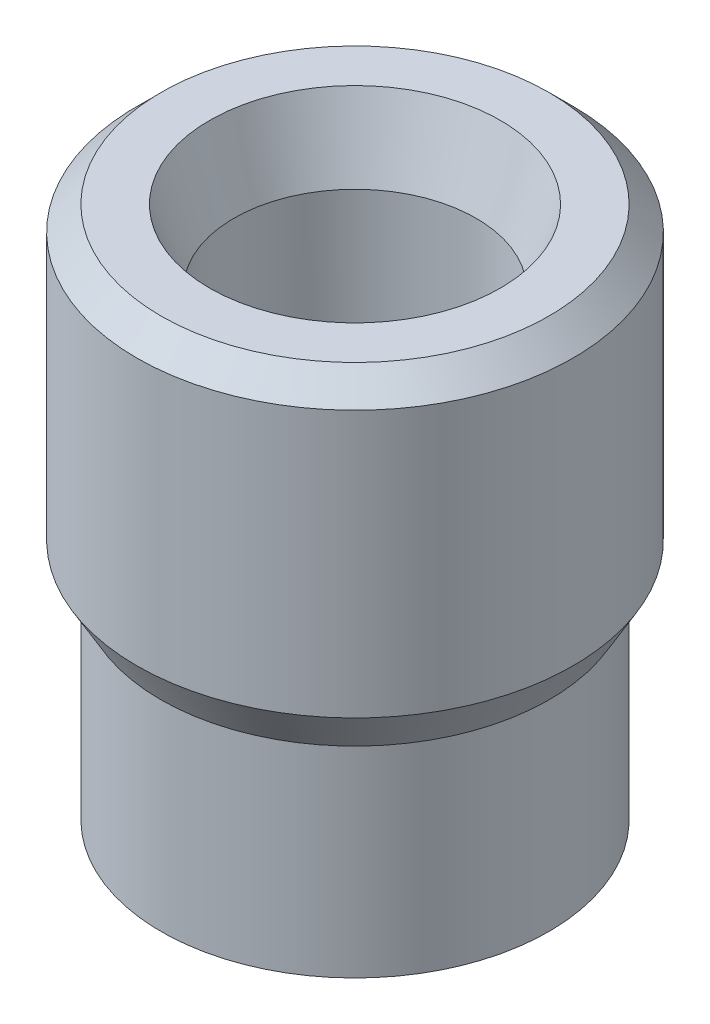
SolidWorks part; units mm, degrees
ref_plane "Přední rovina" through (0, 0, 0) normal (0, 0, 1) x (1, 0, 0)
ref_plane "Horní rovina" through (0, 0, 0) normal (0, 1, 0) x (1, 0, 0)
ref_plane "Pravá rovina" through (0, 0, 0) normal (1, 0, 0) x (0, 0, -1)
sketch "Skica1" plane through (0, 0, 0) normal (0, 1, 0) x (1, 0, 0)
  circle A0 centre (0, 0) radius 8
extrude "Přidat vysunutím1" add sketch "Skica1" along normal blind 8.3
sketch "Skica2" plane through (0, 8.3, 0) normal (0, 1, 0) x (-1, 0, 0)
  circle A0 centre (0, 0) radius 9
extrude "Přidat vysunutím2" add sketch "Skica2" along normal blind 13.7
chamfer "Zkosení1" distance 1.7 angle 30 1 edges at (0, 8.3, 9)
chamfer "Zkosení2" distance 1 angle 45 1 edges at (0, 22, 9)
sketch "Skica3" plane through (0, 0, 0) normal (0, -1, 0) x (1, 0, 0)
  circle A0 centre (0, 0) radius 3
extrude "Odebrat vysunutím1" cut sketch "Skica3" against normal blind 11
sketch "Skica4" plane through (0, 22, 0) normal (0, 1, 0) x (1, 0, 0)
  circle A0 centre (0, 0) radius 5
extrude "Odebrat vysunutím2" cut sketch "Skica4" against normal up to surface (11 mm away)
chamfer "Zkosení3" distance 1 distance2 3 1 edges at (0, 22, 5)
